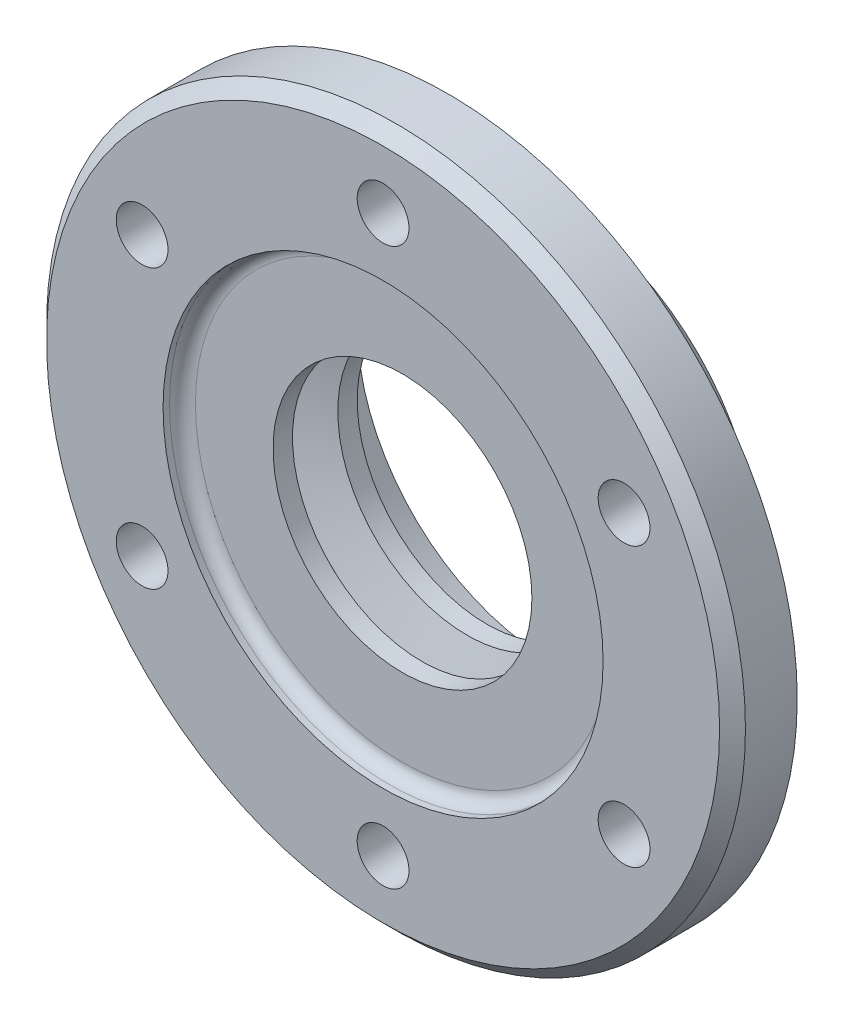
SolidWorks part; units mm, degrees
ref_plane "前视基准面" through (0, 0, 0) normal (0, 0, 1) x (1, 0, 0)
ref_plane "上视基准面" through (0, 0, 0) normal (0, 1, 0) x (1, 0, 0)
ref_plane "右视基准面" through (0, 0, 0) normal (1, 0, 0) x (0, 0, -1)
sketch "草图1" plane through (0, 0, 0) normal (0, 0, 1) x (1, 0, 0)
  circle A0 centre (0, 0) radius 27
extrude "拉伸1" add sketch "草图1" along normal blind 5
sketch "草图2" plane through (0, 0, 0) normal (0, 0, -1) x (-1, 0, 0)
  circle A0 centre (0, 0) radius 16
extrude "拉伸2" add sketch "草图2" along normal blind 2
sketch "草图4" plane through (0, 0, -2) normal (0, 0, -1) x (-1, 0, 0)
  circle A0 centre (0, 0) radius 17
extrude "拉伸3" add sketch "草图4" along normal blind 6
sketch "草图5" plane through (0, 0, 0) normal (1, 0, 0) x (0, 0, -1)
  line L0 (-5, 0) -> (-5, 17)
  line L1 (-5, 27) -> (-5, -27) construction
  line L2 (-5, 17) -> (-3.5, 17)
  line L3 (-3.5, 17) -> (-3.5, 10)
  line L4 (-3.5, 10) -> (-2, 10)
  line L5 (-1, 13.5272) -> (0.5, 13.5272)
  line L6 (-1, 13.5272) -> (-2, 10)
  line L7 (1.5, 10) -> (3, 10)
  line L8 (0.5, 13.5272) -> (1.5, 10)
  line L9 (3, 10) -> (3, 14)
  line L10 (-5, 0) -> (8, 0)
  line L11 (8, -17) -> (8, 17) construction
  line L12 (8, 0) -> (8, 15)
  line L13 (8, 15) -> (3, 14)
  line L14 (-6.8518, 0) -> (10.6028, 0) construction
revolve "切除-旋转1" cut sketch "草图5" angle 360 about L14
chamfer "倒角1" distance 1 angle 45 2 edges at (-17, 0, -8) (27, 0, 5)
fillet "圆角1" radius 1 2 edges at (14, 0, -3) (17, 0, 3.5)
sketch "草图6" plane through (0, 0, 5) normal (0, 0, 1) x (1, 0, 0)
  line L0 (-31.3298, 0) -> (40.0532, 0) construction
  line L1 (0, -33.3191) -> (0, 34.3404) construction
  circle A0 centre (0, 0) radius 21.5 construction
  circle A1 centre (0, -21.5) radius 2
  circle A3 centre (-18.6195, -10.75) radius 2
  circle A4 centre (-18.6195, 10.75) radius 2
  circle A5 centre (0, 21.5) radius 2
  circle A6 centre (18.6195, 10.75) radius 2
  circle A7 centre (18.6195, -10.75) radius 2
  point P7 (0, -21.5)
  point P11 (-18.6195, -10.75)
  point P12 (-18.6195, 10.75)
  point P13 (0, 21.5)
  point P14 (18.6195, 10.75)
  point P15 (18.6195, -10.75)
extrude "切除-拉伸1" cut sketch "草图6" against normal through all
